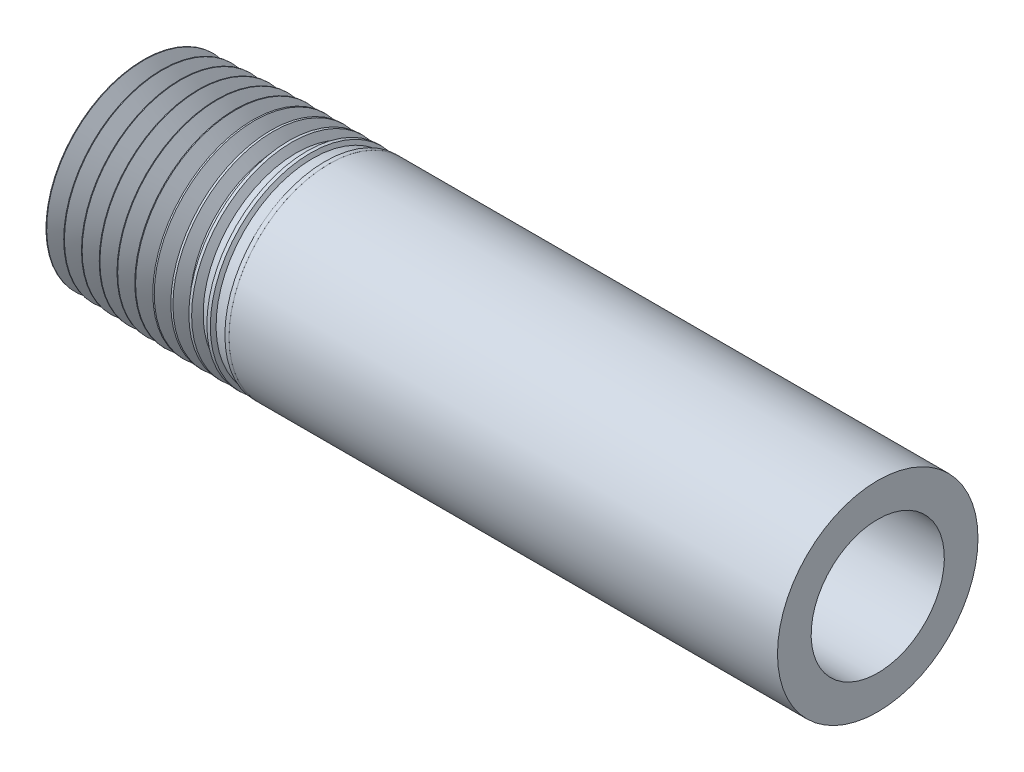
SolidWorks part; units mm, degrees
ref_plane "Front" through (0, 0, 0) normal (0, 0, 1) x (1, 0, 0)
ref_plane "Top" through (0, 0, 0) normal (0, 1, 0) x (1, 0, 0)
ref_plane "Right" through (0, 0, 0) normal (1, 0, 0) x (0, 0, -1)
sketch "Sketch1" plane through (0, 0, 0) normal (0, 0, 1) x (1, 0, 0)
  line L0 (0, 0) -> (0, 4.2025)
  line L1 (0, 4.2025) -> (0.4447, 5.0315) construction
  line L2 (0.4447, 5.0315) -> (0.9403, 4.2319) construction
  line L3 (0.9403, 4.2319) -> (1.385, 5.0609) construction
  line L4 (1.385, 5.0609) -> (1.8806, 4.2613) construction
  line L5 (0.9572, 4.2635) -> (1.368, 5.0293)
  line L6 (1.368, 5.0293) -> (1.4039, 5.0304)
  line L7 (1.4039, 5.0304) -> (1.8617, 4.2918)
  line L8 (1.8617, 4.2918) -> (1.8975, 4.2929)
  line L9 (0, 4.2025) -> (1.8806, 4.2613) construction
  line L10 (0.4447, 5.0315) -> (1.385, 5.0609) construction
  line L11 (0.2223, 4.617) -> (1.6328, 4.6611) construction
  line L12 (0, 0) -> (-4.2025, 0) construction
  line L13 (1.8975, 4.2929) -> (2.3083, 5.0587)
  line L14 (0.017, 4.2342) -> (0.4277, 4.9999)
  line L15 (0.4277, 4.9999) -> (0.4636, 5.0011)
  line L16 (0.4636, 5.0011) -> (0.9214, 4.2624)
  line L17 (0.9214, 4.2624) -> (0.9572, 4.2635)
  line L18 (0.2223, 4.617) -> (0, 4.6101) construction
  line L19 (0, 4.6101) -> (0, 4.2025) construction
  line L20 (0.2223, -4.617) -> (0, -4.6101) construction
  line L21 (0.017, 4.2342) -> (0, 4.2025)
  line L22 (2.3083, 5.0587) -> (2.3441, 5.0598)
  line L23 (2.3441, 5.0598) -> (2.802, 4.3212)
  line L24 (2.802, 4.3212) -> (2.8378, 4.3223)
  line L25 (2.8378, 4.3223) -> (3.2486, 5.0881)
  line L26 (3.2486, 5.0881) -> (3.2844, 5.0892)
  line L27 (3.2844, 5.0892) -> (3.7422, 4.3506)
  line L28 (3.7422, 4.3506) -> (3.7781, 4.3517)
  line L29 (3.7781, 4.3517) -> (4.1889, 5.1175)
  line L30 (4.1889, 5.1175) -> (4.2247, 5.1186)
  line L31 (4.2247, 5.1186) -> (4.6825, 4.38)
  line L32 (4.6825, 4.38) -> (4.7184, 4.3811)
  line L33 (4.7184, 4.3811) -> (5.1291, 5.1469)
  line L34 (5.1291, 5.1469) -> (5.165, 5.148)
  line L35 (5.165, 5.148) -> (5.6228, 4.4093)
  line L36 (5.6228, 4.4093) -> (5.6586, 4.4105)
  line L37 (5.6586, 4.4105) -> (6.0694, 5.1763)
  line L38 (6.0694, 5.1763) -> (6.1053, 5.1774)
  line L39 (6.1053, 5.1774) -> (6.5631, 4.4387)
  line L40 (6.5631, 4.4387) -> (6.5989, 4.4398)
  line L41 (6.5989, 4.4398) -> (7.0097, 5.2056)
  line L42 (7.0097, 5.2056) -> (7.0456, 5.2068)
  line L43 (7.0456, 5.2068) -> (7.5034, 4.4681)
  line L44 (7.5034, 4.4681) -> (7.5392, 4.4692)
  line L45 (7.5392, 4.4692) -> (7.95, 5.235)
  line L46 (7.95, 5.235) -> (7.9858, 5.2361)
  line L47 (7.9858, 5.2361) -> (8.4436, 4.4975)
  line L48 (8.4436, 4.4975) -> (8.4795, 4.4986)
  line L49 (8.4795, 4.4986) -> (8.8903, 5.2644)
  line L50 (8.8903, 5.2644) -> (8.9261, 5.2655)
  line L51 (8.9261, 5.2655) -> (9.3839, 4.5269)
  line L52 (9.3839, 4.5269) -> (9.4198, 4.528)
  line L53 (9.4198, 4.528) -> (9.8306, 5.2938)
  line L54 (9.8306, 5.2938) -> (9.8664, 5.2949)
  line L55 (9.8664, 5.2949) -> (10.3242, 4.5563)
  line L56 (10.3242, 4.5563) -> (10.3601, 4.5574)
  line L57 (10.3601, 4.5574) -> (10.7708, 5.3232)
  line L58 (10.7708, 5.3232) -> (10.8067, 5.3243)
  line L59 (10.8067, 5.3243) -> (11.2645, 4.5857)
  line L60 (11.2645, 4.5857) -> (11.3003, 4.5868)
  line L61 (11.3003, 4.5868) -> (11.7111, 5.3526)
  line L62 (11.7111, 5.3526) -> (11.747, 5.3537)
  line L63 (11.747, 5.3537) -> (12.2048, 4.615)
  line L64 (12.2048, 4.615) -> (12.2406, 4.6162)
  line L65 (12.2406, 4.6162) -> (12.6514, 5.382)
  line L66 (12.6514, 5.382) -> (12.6872, 5.3831)
  line L67 (12.6872, 5.3831) -> (13.145, 4.6444)
  line L68 (13.145, 4.6444) -> (13.1809, 4.6455)
  line L69 (13.1809, 4.6455) -> (13.5917, 5.4113)
  line L70 (13.5917, 5.4113) -> (13.6275, 5.4125)
  line L71 (13.6275, 5.4125) -> (14.0853, 4.6738)
  line L72 (14.0853, 4.6738) -> (14.1212, 4.6749)
  line L73 (0, 0) -> (14.1212, 0)
  line L74 (14.1212, 0) -> (14.1212, 4.6749)
  line L75 (0.4457, 5.0005) -> (0.4447, 5.0315) construction
  line L76 (1.6328, 4.6611) -> (6.7056, 4.8197) construction
  line L77 (6.7056, 4.8197) -> (6.7056, 0) construction
  line L78 (6.7056, 4.8197) -> (9.967, 4.9216) construction
  line L79 (9.967, 4.9216) -> (9.967, 0) construction
  line L80 (9.967, 4.9216) -> (9.967, 5.1435) construction
  line L81 (9.967, 5.1435) -> (14.1212, 5.1435) construction
  line L82 (14.1212, 5.1435) -> (14.1212, 4.6749) construction
  line L83 (0, 3.4163) -> (14.1212, 3.4163) construction
  line L84 (6.7056, 4.4432) -> (9.967, 4.5451) construction
  line L85 (14.1212, 0) -> (38.1, 0) construction
  line L86 (38.1, -0.0474) -> (38.1, 4.2025) construction
  line L87 (38.1, 4.2025) -> (0, 4.2025) construction
  point P74 (9.967, 3.4163)
  point P90 (19.05, 4.2025)
  dimension "D1" = 60
  dimension "D2" = 0.031
  dimension "E0" = 9.2202
  dimension "D3" = 0.0359
  dimension "Thread Pitch" = 0.9407
  dimension "D4" = 3.58
  dimension "L2 Thread Engagement" = 6.7056
  dimension "D6" = 1.7272
  dimension "L4 Thread Length" = 9.967
  dimension "ID" = 6.8326
  dimension "Pipe OD" = 10.287
  dimension "Overall Length" = 38.1
revolve "Revolve1" add sketch "Sketch1" angle 360 about L12
sketch "Sketch5" plane through (0, 0, 0) normal (0, 0, 1) x (1, 0, 0)
  line L0 (9.967, 0) -> (9.967, 5.2981)
  line L1 (9.967, 5.2981) -> (14.1212, 5.4279)
  line L2 (14.1212, 5.4279) -> (14.1212, 0)
  line L3 (14.1212, 0) -> (9.967, 0)
  line L4 (0, 0) -> (-4.2025, 0) construction
  line L5 (0, 0) -> (-4.2025, 0) construction
  line L6 (13.5917, 5.4113) -> (13.6275, 5.4125) construction
revolve "Cut-Revolve2" cut sketch "Sketch5" angle 360 about L5
sketch "Sketch2" plane through (0, 0, 0) normal (0, 0, 1) x (1, 0, 0)
  line L0 (0, 0) -> (0, 4.2025) construction
  line L1 (14.1212, 5.1435) -> (0, 5.1435)
  line L2 (14.1212, 5.1435) -> (14.1212, 11.4935)
  line L3 (14.1212, 11.4935) -> (0, 11.4935)
  line L4 (0, 5.1435) -> (0, 11.4935)
  line L5 (0, 0) -> (-4.2025, 0) construction
  line L6 (0, 0) -> (14.1212, 0)
  line L7 (0, 0) -> (0, 3.4163)
  line L8 (0, 3.4163) -> (14.1212, 3.4163)
  line L9 (14.1212, 0) -> (14.1212, 3.4163)
  line L10 (0, 0) -> (-4.2025, 0) construction
  dimension "D1" = 6.35
revolve "Cut-Revolve1" cut sketch "Sketch2" angle 360 about L10
sketch "Sketch3" plane through (0, 0, 0) normal (0, 0, 1) x (1, 0, 0)
  line L0 (9.967, 3.4163) -> (6.7056, 3.4163)
  line L2 (6.7056, 4.8197) -> (6.7056, 0) construction
  line L4 (6.7056, 3.4163) -> (6.7056, 4.4432)
  line L5 (0, 0) -> (-4.2025, 0) construction
  line L6 (0, 0) -> (-4.2025, 0) construction
  line L7 (6.7056, 4.4432) -> (9.967, 5.1435)
  line L9 (9.967, 5.1435) -> (9.967, 3.4163)
  line L10 (9.967, 4.9216) -> (9.967, 0) construction
  line L12 (9.967, 5.1435) -> (14.1212, 5.1435) construction
  line L13 (0, 3.4163) -> (14.1212, 3.4163) construction
revolve "Revolve2" add sketch "Sketch3" angle 360 about L6
ref_plane "Thread Engagement Plane Left" through (6.7056, 0, 0) normal (1, 0, 0) x (0, 0, -1)
sketch "Sketch4" plane through (9.967, 0, 0) normal (1, 0, 0) x (0, 0, -1)
  line L0 (0, 0) -> (-3.4163, 0) construction
  line L1 (-3.4163, 0) -> (-5.1435, 0) construction
  circle A1 centre (0, 0) radius 3.4163
  circle A3 centre (0, 0) radius 5.1435
  dimension "D2" = 6.8326
  dimension "D3" = 10.287
  dimension "D1" = 1.7272
extrude "Extrude1" add sketch "Sketch4" along normal up to vertex (28.133 mm away)
equation "\"D2@Sketch1\"=\"Thread Pitch@Sketch1\"*.033"
